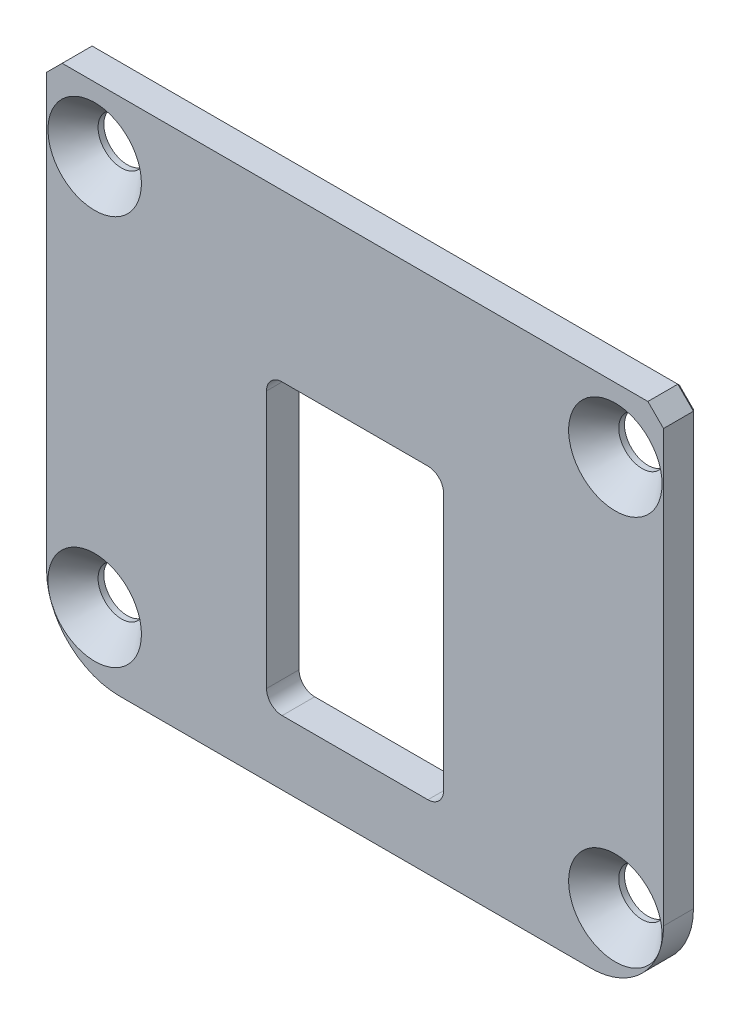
SolidWorks part; units mm, degrees
ref_plane "Front Plane" through (0, 0, 0) normal (0, 0, 1) x (1, 0, 0)
ref_plane "Top Plane" through (0, 0, 0) normal (0, 1, 0) x (1, 0, 0)
ref_plane "Right Plane" through (0, 0, 0) normal (1, 0, 0) x (0, 0, -1)
sketch "Sketch1" plane through (0, 0, 0) normal (0, 0, 1) x (1, 0, 0)
  line L1 (-30.099, 0) -> (30.099, 0)
  line L2 (-30.099, 0) -> (-30.099, -50.673)
  line L3 (-30.099, -50.673) -> (30.099, -50.673)
  line L4 (30.099, 0) -> (30.099, -50.673)
  dimension "D1" = 60.198
  dimension "D2" = 50.673
extrude "Boss-Extrude1" add sketch "Sketch1" against normal blind 3.175
chamfer "Chamfer1" distance 1.524 angle 45 2 edges at (-30.099, 0, -1.5875) (30.099, 0, -1.5875)
fillet "Fillet1" radius 7.112 2 edges at (-30.099, -50.673, -1.5875) (30.099, -50.673, -1.5875)
hole_wizard "CSK for #8 Flat Head Socket Cap Screw1" positions "Sketch2" profile "Sketch3" countersink size "#8" standard "ANSI Inch"
sketch "Sketch2" plane through (0, 0, 0) normal (0, 0, 1) x (1, 0, 0)
  line L0 (0, 0) -> (0, -50.673) construction
  line L1 (28.575, 0) -> (-28.575, 0) construction
  line L3 (-22.987, -50.673) -> (22.987, -50.673) construction
  line L4 (0, -25.3365) -> (-22.3569, -25.3365) construction
  point P0 (-25.4, -6.2865)
  point P2 (-25.4, -44.3865)
  point P11 (25.4, -44.3865)
  point P12 (25.4, -6.2865)
  dimension "D1" = 50.8
  dimension "D2" = 19.05
  dimension "D3" = 19.05
sketch "Sketch3" plane through (-25.4, -6.2865, 0) normal (1, 0, 0) x (0, -1, 0)
  line L0 (0, 0) -> (0, 3.175)
  line L1 (0, 3.175) -> (2.286, 3.175)
  line L2 (2.286, 3.175) -> (2.286, 2.6151)
  line L3 (2.286, 2.6151) -> (4.5593, 0)
  line L5 (4.5593, 0) -> (0, 0)
  line L6 (-2.286, 2.6151) -> (-4.5593, 0) construction
  line L11 (0, -6.35) -> (0, 107.95) construction
  dimension "Thru Hole Dia." = 4.572
  dimension "Thru Hole Depth" = 3.175
  dimension "Near C'Sink Dia." = 9.1186
  dimension "Near C'Sink Angle" = 82
chamfer "Chamfer2" distance 0.254 angle 45 8 edges at (29.337, -0.762, -3.175) (0, 0, -3.175) (-29.337, -0.762, -3.175) (-30.099, -22.5425, -3.175) (30.099, -22.5425, -3.175) (-28.0159, -48.5899, -3.175) (28.0159, -48.5899, -3.175) (0, -50.673, -3.175)
sketch "Sketch4" plane through (0, 0, 0) normal (0, 0, 1) x (1, 0, 0)
  line L0 (0, 0) -> (0, -44.3865) construction
  line L1 (-7.112, -16.1925) -> (7.112, -16.1925)
  line L2 (-8.636, -17.7165) -> (-8.636, -42.8625)
  line L3 (-7.112, -44.3865) -> (7.112, -44.3865)
  line L4 (8.636, -17.7165) -> (8.636, -42.8625)
  line L5 (-22.987, -50.673) -> (22.987, -50.673) construction
  arc A0 (7.112, -16.1925) -> (8.636, -17.7165) centre (7.112, -17.7165) cw
  arc A1 (-8.636, -42.8625) -> (-7.112, -44.3865) centre (-7.112, -42.8625) ccw
  arc A2 (7.112, -44.3865) -> (8.636, -42.8625) centre (7.112, -42.8625) ccw
  arc A3 (-7.112, -16.1925) -> (-8.636, -17.7165) centre (-7.112, -17.7165) ccw
  point P13 (-8.636, -44.3865)
  point P16 (8.636, -44.3865)
  dimension "D4" = 1.524
  dimension "D1" = 28.194
  dimension "D2" = 17.272
  dimension "D3" = 6.2865
extrude "Cut-Extrude1" cut sketch "Sketch4" against normal through all
ref_plane "Mid-Plane" through (0, -25.3365, 0) normal (0, 1, 0) x (1, 0, 0)
